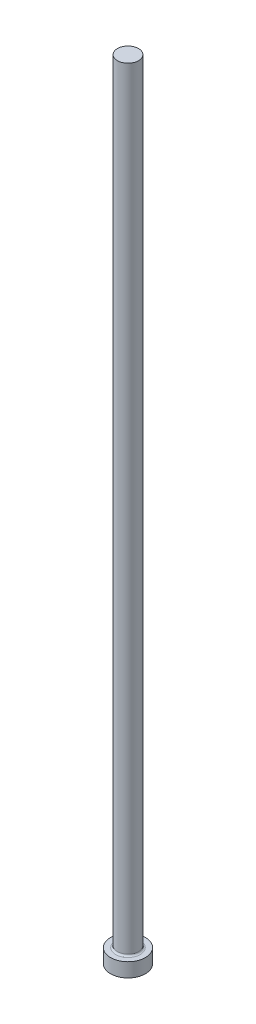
SolidWorks part; units mm, degrees
ref_plane "Front Plane" through (0, 0, 0) normal (0, 0, 1) x (1, 0, 0)
ref_plane "Top Plane" through (0, 0, 0) normal (0, 1, 0) x (1, 0, 0)
ref_plane "Right Plane" through (0, 0, 0) normal (1, 0, 0) x (0, 0, -1)
sketch "Sketch1" plane through (0, 0, 0) normal (0, 0, 1) x (1, 0, 0)
  line L0 (0, 0) -> (7.874, 0)
  line L1 (8.6614, 0) -> (-8.6614, 0) construction
  line L2 (7.874, 0) -> (7.874, 6.35)
  line L3 (7.874, 6.35) -> (5.5245, 6.35)
  line L4 (4.7625, 7.112) -> (4.7625, 355.6)
  line L5 (4.7625, 355.6) -> (0, 355.6)
  line L6 (0, 355.6) -> (0, 0)
  arc A0 (5.5245, 6.35) -> (4.7625, 7.112) centre (5.5245, 7.112) cw
  dimension "D5" = 0.762
  dimension "D1" = 4.7625
  dimension "D2" = 7.874
  dimension "D3" = 6.35
  dimension "D4" = 355.6
revolve "Revolve1" add sketch "Sketch1" angle 360 about L6
